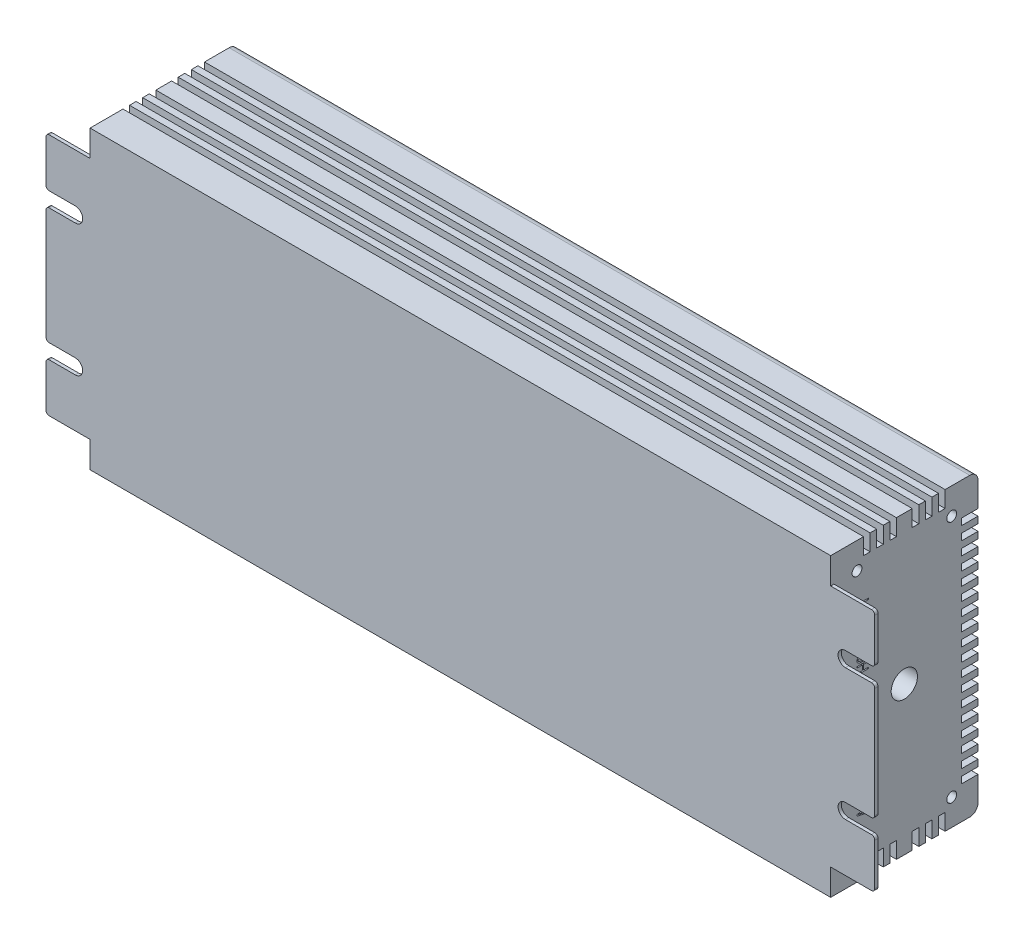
SolidWorks part; units mm, degrees
ref_plane "Plan de face" through (0, 0, 0) normal (0, 0, 1) x (1, 0, 0)
ref_plane "Plan de dessus" through (0, 0, 0) normal (0, 1, 0) x (1, 0, 0)
ref_plane "Plan de droite" through (0, 0, 0) normal (1, 0, 0) x (0, 0, -1)
sketch "Esquisse1" plane through (0, 0, 0) normal (0, 0, 1) x (1, 0, 0)
  line L0 (112.6, 37) -> (125, 37)
  line L1 (112.6, -37) -> (112.6, 37)
  line L2 (-117.1, -17.75) -> (-125, -17.75)
  line L3 (125, -37) -> (112.6, -37)
  line L4 (-117.1, 22.25) -> (-125, 22.25)
  line L5 (126, 16.75) -> (126, -16.75)
  line L6 (0, -45) -> (0, 45) construction
  line L7 (-112.6, 45) -> (112.6, 45)
  line L8 (-112.6, 45) -> (-112.6, -45)
  line L9 (-112.6, -45) -> (112.6, -45)
  line L10 (126, -36) -> (126, -23.25)
  line L11 (-112.6, 0) -> (112.6, 0) construction
  line L12 (-117.1, 17.75) -> (-125, 17.75)
  line L13 (-126, 36) -> (-126, 23.25)
  line L14 (-117.1, -22.25) -> (-125, -22.25)
  line L15 (-126, -36) -> (-126, -23.25)
  line L16 (-126, 16.75) -> (-126, -16.75)
  line L17 (-125, -37) -> (-112.6, -37)
  line L18 (-112.6, -37) -> (-112.6, 37)
  line L19 (-112.6, 37) -> (-125, 37)
  line L20 (117.1, -22.25) -> (125, -22.25)
  line L21 (126, 36) -> (126, 23.25)
  line L22 (117.1, 17.75) -> (125, 17.75)
  line L23 (112.6, 45) -> (112.6, -45)
  line L24 (117.1, 22.25) -> (125, 22.25)
  line L25 (117.1, -17.75) -> (125, -17.75)
  arc A0 (-117.1, 17.75) -> (-117.1, 22.25) centre (-117.1, 20) ccw
  arc A1 (-117.1, -17.75) -> (-117.1, -22.25) centre (-117.1, -20) cw
  arc A2 (-125, -37) -> (-126, -36) centre (-125, -36) cw
  arc A3 (-126, -23.25) -> (-125, -22.25) centre (-125, -23.25) cw
  arc A4 (-125, -17.75) -> (-126, -16.75) centre (-125, -16.75) cw
  arc A5 (-126, 16.75) -> (-125, 17.75) centre (-125, 16.75) cw
  arc A6 (-125, 22.25) -> (-126, 23.25) centre (-125, 23.25) cw
  arc A7 (-126, 36) -> (-125, 37) centre (-125, 36) cw
  circle A8 centre (0, 0) radius 5
  arc A9 (126, 36) -> (125, 37) centre (125, 36) ccw
  arc A10 (125, 22.25) -> (126, 23.25) centre (125, 23.25) ccw
  arc A11 (126, 16.75) -> (125, 17.75) centre (125, 16.75) ccw
  arc A12 (125, -17.75) -> (126, -16.75) centre (125, -16.75) ccw
  arc A13 (126, -23.25) -> (125, -22.25) centre (125, -23.25) ccw
  arc A14 (125, -37) -> (126, -36) centre (125, -36) ccw
  arc A15 (117.1, -17.75) -> (117.1, -22.25) centre (117.1, -20) ccw
  arc A16 (117.1, 17.75) -> (117.1, 22.25) centre (117.1, 20) cw
  point P30 (-126, -37)
  point P33 (-126, -22.25)
  point P36 (-126, -17.75)
  point P39 (-126, 17.75)
  point P42 (-126, 22.25)
  point P45 (-126, 37)
  point P69 (126, 37)
  point P70 (126, 22.25)
  point P71 (126, 17.75)
  point P72 (126, -17.75)
  point P73 (126, -22.25)
  point P74 (126, -37)
  dimension "D2" = 74
  dimension "D1" = 90
  dimension "D5" = 33.5
  dimension "D3" = 40
  dimension "D4" = 12.75
  dimension "D6" = 225.2
ref_plane "Plan5" through (112.6, 0, 0) normal (1, 0, 0) x (0, 0, -1)
sketch "Esquisse7" plane through (112.6, 0, 0) normal (1, 0, 0) x (0, 0, -1)
  line L0 (43.8, 0) -> (0, 0) construction
  line L1 (43.8, 45) -> (43.8, -45) construction
  line L2 (0, 37) -> (0, -37) construction
  line L3 (21.4, 45) -> (21.4, -45) construction
  line L4 (-1, 45) -> (43.8, 45) construction
  line L5 (-1, -45) -> (43.8, -45) construction
  line L6 (43.8, 42.5) -> (43.8, 35)
  line L7 (43.8, 35) -> (38.8, 35)
  line L8 (38.8, 35) -> (38.8, 33)
  line L9 (33.8, -45) -> (41.3, -45)
  line L10 (-1, 45) -> (-1, -45)
  line L11 (38.8, 33) -> (43.8, 33)
  line L12 (43.8, 33) -> (43.8, 31)
  line L13 (43.8, 31) -> (38.8, 31)
  line L14 (38.8, 31) -> (38.8, 29)
  line L15 (38.8, 29) -> (43.8, 29)
  line L16 (43.8, 29) -> (43.8, 27)
  line L17 (43.8, 27) -> (38.8, 27)
  line L18 (38.8, 27) -> (38.8, 25)
  line L19 (38.8, 25) -> (43.8, 25)
  line L20 (43.8, 25) -> (43.8, 23)
  line L21 (43.8, 23) -> (38.8, 23)
  line L22 (38.8, 23) -> (38.8, 21)
  line L23 (38.8, 21) -> (43.8, 21)
  line L24 (43.8, 21) -> (43.8, 19)
  line L25 (38.8, 19) -> (38.8, 17)
  line L26 (43.8, 15) -> (38.8, 15)
  line L27 (38.8, 7) -> (38.8, 5)
  line L28 (43.8, 13) -> (43.8, 11)
  line L29 (38.8, 11) -> (38.8, 9)
  line L30 (38.8, 13) -> (43.8, 13)
  line L31 (43.8, 7) -> (38.8, 7)
  line L32 (43.8, 11) -> (38.8, 11)
  line L33 (43.8, 19) -> (38.8, 19)
  line L34 (43.8, 9) -> (43.8, 7)
  line L35 (43.8, 5) -> (43.8, 3)
  line L36 (38.8, 9) -> (43.8, 9)
  line L37 (43.8, 17) -> (43.8, 15)
  line L38 (38.8, 5) -> (43.8, 5)
  line L39 (38.8, 15) -> (38.8, 13)
  line L40 (38.8, 17) -> (43.8, 17)
  line L41 (38.8, 3) -> (38.8, 1)
  line L42 (43.8, -1) -> (38.8, -1)
  line L43 (38.8, -9) -> (38.8, -11)
  line L44 (43.8, -3) -> (43.8, -5)
  line L45 (38.8, -5) -> (38.8, -7)
  line L46 (38.8, -3) -> (43.8, -3)
  line L47 (43.8, -9) -> (38.8, -9)
  line L48 (43.8, -5) -> (38.8, -5)
  line L49 (43.8, 3) -> (38.8, 3)
  line L50 (43.8, -7) -> (43.8, -9)
  line L51 (43.8, -11) -> (43.8, -13)
  line L52 (38.8, -7) -> (43.8, -7)
  line L53 (43.8, 1) -> (43.8, -1)
  line L54 (38.8, -11) -> (43.8, -11)
  line L55 (38.8, -1) -> (38.8, -3)
  line L56 (38.8, 1) -> (43.8, 1)
  line L57 (38.8, -13) -> (38.8, -15)
  line L58 (43.8, -17) -> (38.8, -17)
  line L59 (38.8, -25) -> (38.8, -27)
  line L60 (43.8, -19) -> (43.8, -21)
  line L61 (38.8, -21) -> (38.8, -23)
  line L62 (38.8, -19) -> (43.8, -19)
  line L63 (43.8, -25) -> (38.8, -25)
  line L64 (43.8, -21) -> (38.8, -21)
  line L65 (43.8, -13) -> (38.8, -13)
  line L66 (43.8, -23) -> (43.8, -25)
  line L67 (43.8, -27) -> (43.8, -29)
  line L68 (38.8, -23) -> (43.8, -23)
  line L69 (43.8, -15) -> (43.8, -17)
  line L70 (38.8, -27) -> (43.8, -27)
  line L71 (38.8, -17) -> (38.8, -19)
  line L72 (38.8, -15) -> (43.8, -15)
  line L73 (38.8, -29) -> (38.8, -31)
  line L74 (43.8, -33) -> (38.8, -33)
  line L75 (43.8, -42.5) -> (43.8, -35)
  line L76 (43.8, -35) -> (38.8, -35)
  line L77 (9, -45) -> (-1, -45)
  line L78 (33.8, -45) -> (33.8, -40)
  line L79 (33.8, -40) -> (31.8, -40)
  line L80 (31.8, -40) -> (31.8, -45)
  line L81 (43.8, -29) -> (38.8, -29)
  line L82 (31.8, -45) -> (29.8, -45)
  line L83 (29.8, -45) -> (29.8, -40)
  line L84 (29.8, -40) -> (27.8, -40)
  line L85 (43.8, -31) -> (43.8, -33)
  line L86 (27.8, -40) -> (27.8, -45)
  line L87 (38.8, -33) -> (38.8, -35)
  line L88 (38.8, -31) -> (43.8, -31)
  line L89 (27.8, -45) -> (25.8, -45)
  line L90 (25.8, -45) -> (25.8, -40)
  line L91 (25.8, -40) -> (23.8, -40)
  line L92 (23.8, -40) -> (23.8, -45)
  line L93 (23.8, -45) -> (21.4, -45)
  line L94 (19, -40) -> (19, -45)
  line L95 (17, -40) -> (19, -40)
  line L96 (17, -45) -> (17, -40)
  line L97 (15, -45) -> (17, -45)
  line L98 (15, -40) -> (15, -45)
  line L99 (13, -40) -> (15, -40)
  line L100 (13, -45) -> (13, -40)
  line L101 (11, -45) -> (13, -45)
  line L102 (11, -40) -> (11, -45)
  line L103 (9, -40) -> (11, -40)
  line L104 (9, -45) -> (9, -40)
  line L105 (-1, -45) -> (-1, 45)
  line L106 (23.8, -45) -> (19, -45)
  line L107 (9, -45) -> (-1, -45)
  line L108 (-1, 45) -> (-1, -45)
  line L109 (19, 45) -> (23.8, 45)
  line L110 (9, 45) -> (9, 40)
  line L111 (9, 40) -> (11, 40)
  line L112 (11, 40) -> (11, 45)
  line L113 (11, 45) -> (13, 45)
  line L114 (13, 45) -> (13, 40)
  line L115 (13, 40) -> (15, 40)
  line L116 (15, 40) -> (15, 45)
  line L117 (15, 45) -> (17, 45)
  line L118 (17, 45) -> (17, 40)
  line L119 (17, 40) -> (19, 40)
  line L120 (19, 40) -> (19, 45)
  line L121 (23.8, -45) -> (19, -45)
  line L122 (23.8, 40) -> (23.8, 45)
  line L123 (25.8, 40) -> (23.8, 40)
  line L124 (25.8, 45) -> (25.8, 40)
  line L125 (27.8, 45) -> (25.8, 45)
  line L126 (27.8, 40) -> (27.8, 45)
  line L127 (29.8, 40) -> (27.8, 40)
  line L128 (29.8, 45) -> (29.8, 40)
  line L129 (31.8, 45) -> (29.8, 45)
  line L130 (31.8, 40) -> (31.8, 45)
  line L131 (33.8, 40) -> (31.8, 40)
  line L132 (33.8, 45) -> (33.8, 40)
  line L133 (33.8, 45) -> (41.3, 45)
  line L134 (43.8, 35) -> (43.8, 45)
  line L135 (-1, 45) -> (9, 45)
  circle A0 centre (35.8, 37) radius 1.5
  circle A1 centre (21.4, 0) radius 4
  circle A2 centre (21.4, 0) radius 2.5
  circle A3 centre (7, 37) radius 1.5
  circle A4 centre (7, -37) radius 1.5
  circle A5 centre (35.8, -37) radius 1.5
  arc A6 (41.3, -45) -> (43.8, -42.5) centre (41.3, -42.5) ccw
  arc A7 (41.3, 45) -> (43.8, 42.5) centre (41.3, 42.5) cw
  dimension "D1" = 2.5
extrude "Boss.-Extru.3" add sketch "Esquisse7" against normal blind 225.2 contours A7 L133 L132 L131 L130 L129 L128 L127 L126 L125 L124 L123 L122 L109 L120 L119 L118 L117 L116 L115 L114 L113 L112 L111 L110 L135 L10 L77 L104 L103 L102 L101 L100 L99 L98 L97 L96 L95 L94 L106 L93 L92 L91 L90 L89 L86 L84 L83 L82 L80 L79
extrude "Boss.-Extru.4" add sketch "Esquisse1" along normal blind 1 contours L22 A16 L24 A10 L21 A9 L0 L1 L3 A14 L10 A13 L20 A15 L25 A12 L5 A11 | L23 L7 L8 L9 L1 A8 | A7 L13 A6 L4 A0 L12 A5 L16 A4 L2 A1 L14 A3 L15 A2 L17 L8 L19
sketch "Esquisse8" plane through (112.6, 0, 0) normal (1, 0, 0) x (0, 0, -1)
  line L0 (7, 37) -> (7, -37) construction
  text T0 "HLG-320H - 36VDC 8.5A 320W" font "Arial Narrow" height 3.5
extrude "Enlèv. mat.-Extru.1" cut sketch "Esquisse8" against normal blind 1
